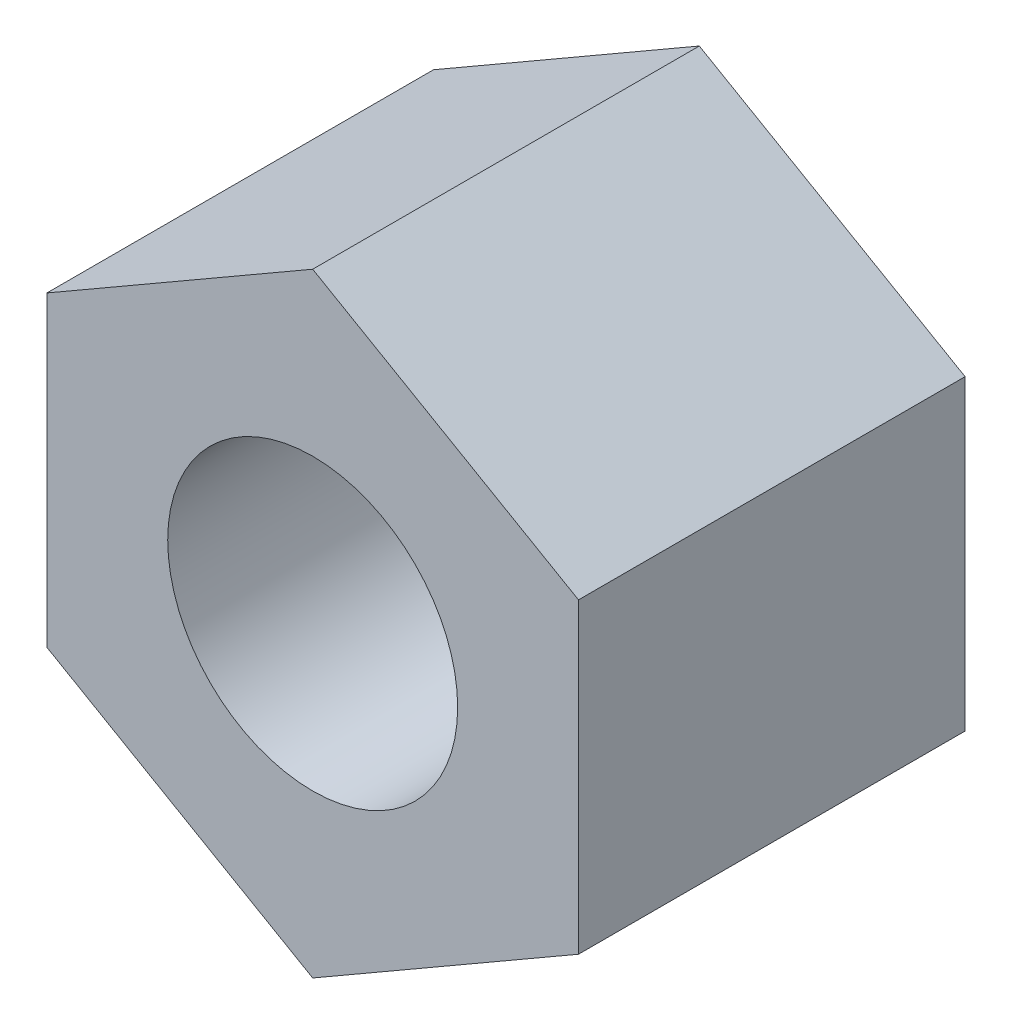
SolidWorks part; units mm, degrees
ref_plane "前视基准面" through (0, 0, 0) normal (0, 0, 1) x (1, 0, 0)
ref_plane "上视基准面" through (0, 0, 0) normal (0, 1, 0) x (1, 0, 0)
ref_plane "右视基准面" through (0, 0, 0) normal (1, 0, 0) x (0, 0, -1)
other "Configuration Table"
sketch "草图1" plane through (0, 0, 0) normal (0, 0, 1) x (1, 0, 0)
  line L0 (2.75, 1.5877) -> (0, 3.1754)
  line L1 (0, 3.1754) -> (-2.75, 1.5877)
  line L2 (-2.75, 1.5877) -> (-2.75, -1.5877)
  line L3 (-2.75, -1.5877) -> (0, -3.1754)
  line L4 (0, -3.1754) -> (2.75, -1.5877)
  line L5 (2.75, -1.5877) -> (2.75, 1.5877)
  circle A0 centre (0, 0) radius 1.5
  dimension "D1" = 3
  dimension "D2" = 2.75
  dimension "D3" = 1.5877
  dimension "D4" = 3.1754
extrude "Unthreaded_nominal_nut" add sketch "草图1" along normal blind 4
